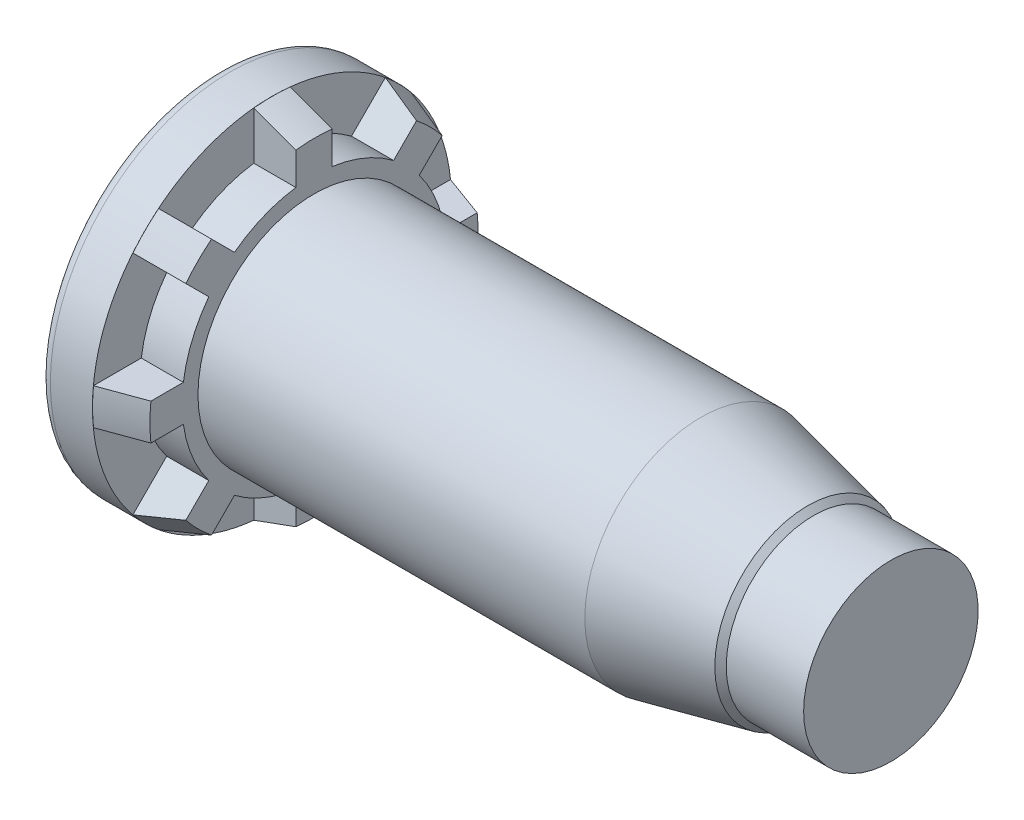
SolidWorks part; units mm, degrees
ref_plane "Plane1" through (0, 0, 0) normal (0, 0, 1) x (1, 0, 0)
ref_plane "Plane2" through (0, 0, 0) normal (0, 1, 0) x (1, 0, 0)
ref_plane "Plane3" through (0, 0, 0) normal (1, 0, 0) x (0, 0, -1)
sketch "BodySke" plane through (0, 0, 0) normal (0, 0, 1) x (1, 0, 0)
  line L0 (-2.159, 6.9342) -> (-2.159, 0)
  line L1 (1.7272, 6.7357) -> (1.7272, 4.7625)
  line L2 (0.0025, 7.3635) -> (1.7272, 6.7357)
  line L3 (1.7272, 4.7625) -> (17.6022, 4.7625)
  line L4 (17.6022, 4.7625) -> (21.99, 3.8163)
  line L5 (25.4, 0) -> (-2.159, 0)
  line L6 (0, 0) -> (50.554, 0) construction
  line L7 (22.225, 3.5814) -> (25.4, 3.5814)
  line L8 (22.225, 3.5814) -> (21.99, 3.8163)
  line L9 (-1.7272, 7.366) -> (0, 7.366)
  line L10 (0.0025, 7.3635) -> (0, 7.3635)
  line L11 (1.5875, 19.05) -> (1.5875, -3.175) construction
  line L12 (0, 7.3635) -> (0, 7.366)
  line L13 (25.4, 3.5814) -> (25.4, 0)
  arc A0 (-2.159, 6.9342) -> (-1.7272, 7.366) centre (-1.7272, 6.9342) cw
  dimension "D2" = 0.0025
  dimension "Fillet_rad" = 0.4318
  dimension "D1" = 20
  dimension "Diameter" = 9.525
  dimension "D3" = 0.0025
  dimension "D4" = 45
  dimension "Length" = 25.4
  dimension "Minor_dia" = 7.6327
  dimension "Advance" = 1.5875
  dimension "H_dia" = 14.732
  dimension "T_dim" = 2.159
  dimension "Clinch_ht" = 1.7272
  dimension "Dog_len" = 3.175
  dimension "Dog_dia" = 7.1628
  dimension "Thread_trans" = 4.6228
revolve "BaseBody" add sketch "BodySke" angle 360 about L6
sketch "ThdSchSke" plane through (0, 0, 0) normal (0, 0, 1) x (1, 0, 0)
  line L0 (3.937, -3.8163) -> (3.2745, -4.7625)
  line L1 (3.937, -3.8163) -> (4.5995, -4.7625)
  line L2 (4.5995, -4.7625) -> (4.5995, -5.9531)
  line L3 (-3.175, 0) -> (5.1513, 0) construction
  line L4 (0, -7.366) -> (0, 7.366) construction
  line L5 (4.5995, -5.9531) -> (3.2745, -5.9531)
  line L6 (3.2745, -5.9531) -> (3.2745, -4.7625)
  line L7 (21.9888, 6.5809) -> (21.9888, 1.1961) construction
  dimension "Thread_minor" = 7.6327
  dimension "Diameter" = 9.525
  dimension "Start" = 3.937
  dimension "SideAngle" = 55
  dimension "VeeAngle" = 70
  dimension "Overcut" = 11.9063
  dimension "Thread_length" = 18.0518
revolve "ThreadSchematic" [suppressed] cut sketch "ThdSchSke" angle 360 about L3
pattern_linear "ThdSchPat" [suppressed]
sketch "RibCutSke" plane through (1.7272, 1.7944, -0.091) normal (1, 0, 0) x (0, 0, -1)
  line L0 (0.6541, 3.5675) -> (0.6541, 5.5338)
  line L1 (3.1736, 2.5238) -> (4.5641, 3.9142)
  line L2 (0.6541, 2.9095) -> (0.6541, 2.4006) construction
  line L3 (-0.091, -1.7944) -> (-0.091, 5.0239) construction
  line L4 (-0.091, -1.7944) -> (0.6541, 2.9095) construction
  line L5 (-0.091, -1.7944) -> (2.7084, 2.0585) construction
  line L6 (2.7084, 2.0585) -> (2.3536, 1.7038) construction
  arc A1 (3.1736, 2.5238) -> (0.6541, 3.5675) centre (-0.091, -1.7944) ccw
  arc A2 (4.5641, 3.9142) -> (0.6541, 5.5338) centre (-0.091, -1.7944) ccw
  circle A3 centre (-0.091, -1.7944) radius 6.7357 construction
  circle A4 centre (-0.091, -1.7944) radius 4.7625 construction
  dimension "Inner_dia" = 10.8267
  dimension "Outer_dia" = 14.732
  dimension "Rib_root_dia" = 9.525
  dimension "Rib_root_half_angle" = 9
  dimension "Rib_root_gap_angle" = 27
  dimension "Angle" = 45
extrude "RibCut" cut sketch "RibCutSke" against normal blind 1.7272
pattern_circular "RibCutsPat" count 8 every 45 about axis through (0, 0, 0) along (1, 0, 0) of "RibCut"
equation "' \"Length@BodySke\" = 1"
equation "' \"H_dia@BodySke\" = 0.58"
equation "' \"Start@ThdSchSke\" = 0.155"
equation "' \"T_dim@BodySke\" = 0.085"
equation "' \"Dog_dia@BodySke\" = 0.282"
equation "' \"Dog_len@BodySke\" = 0.125"
equation "' \"Thread_trans@BodySke\" = 0.182"
equation "' \"Diameter@BodySke\" = 0.375"
equation "' \"Minor_dia@BodySke\" =  0.3005"
equation "' \"Advance@BodySke\" = 0.0625"
equation "\"Fillet_rad@BodySke\" =  \"T_dim@BodySke\" * 0.2"
equation "\"Clinch_ht@BodySke\" = \"T_dim@BodySke\" * 0.8"
equation "\"Num_ribs@RibCutsPat\" = 8"
equation "\"Angle@RibCutSke\" =\"Angle@RibCutsPat\""
equation "\"Rib_root_half_angle@RibCutSke\" = \"Angle@RibCutSke\" / 5"
equation "\"Rib_root_gap_angle@RibCutSke\" = \"Angle@RibCutSke\" - (2 * \"Rib_root_half_angle@RibCutSke\" )"
equation "\"Rib_root_dia@RibCutSke\" = \"Diameter@BodySke\""
equation "\"Inner_dia@RibCutSke\" = \"Diameter@BodySke\" + ( \"H_dia@BodySke\" - \"Diameter@BodySke\" ) / 4"
equation "\"Outer_dia@RibCutSke\" = \"H_dia@BodySke\""
equation "\"Depth@RibCut\" = \"Clinch_ht@BodySke\""
equation "\"Thread_length@ThreadCosmetic\" = \"Length@BodySke\" - \"Start@ThdSchSke\"  - \"Dog_len@BodySke\"  - ( \"Minor_dia@BodySke\" - \"Dog_dia@BodySke\" ) / 2"
equation "\"Thread_minor@ThreadCosmetic\" = \"Minor_dia@BodySke\""
equation "\"Thread_minor@ThdSchSke\" = \"Minor_dia@BodySke\""
equation "\"Diameter@ThdSchSke\" = \"Diameter@BodySke\""
equation "\"Overcut@ThdSchSke\" = \"Diameter@BodySke\" * 1.25"
equation "\"Num_threads@ThdSchPat\" = int( \"Thread_length@ThreadCosmetic\" / \"Advance@BodySke\" + 0.999 )  + 1"
equation "\"Advance@ThdSchPat\" = \"Thread_length@ThreadCosmetic\" /  (\"Num_threads@ThdSchPat\" - 1) 'relax it"
equation "\"Num_threads@ThdSchPat\" = \"Num_threads@ThdSchPat\" - sgn( \"Num_threads@ThdSchPat\" - 1) '---chamfered tips only---"
